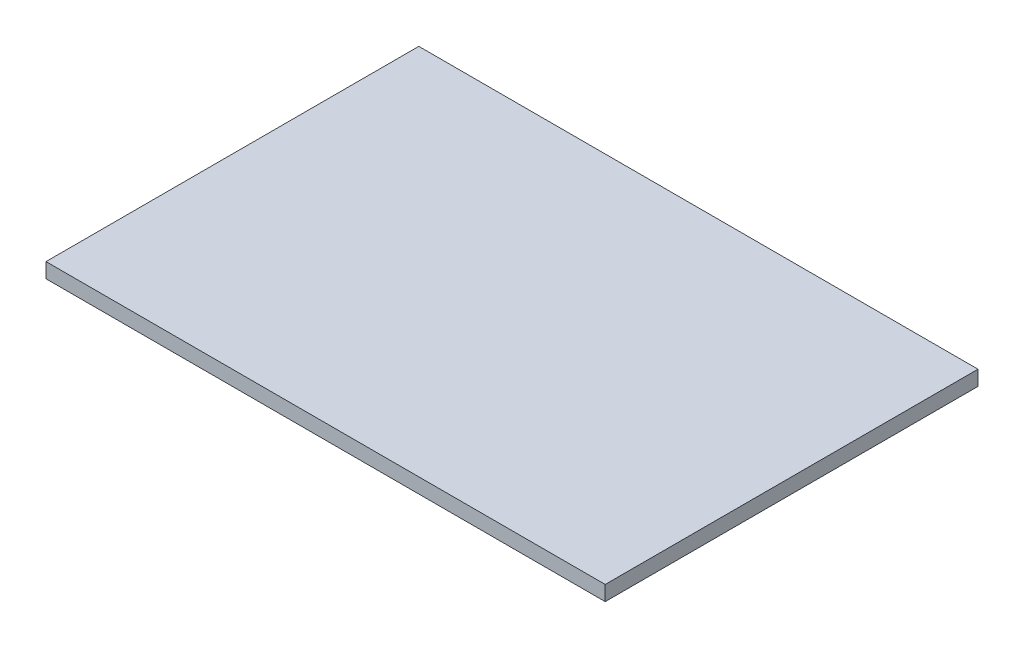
SolidWorks part; units mm, degrees
ref_plane "Face" through (0, 0, 0) normal (0, 0, 1) x (1, 0, 0)
ref_plane "Dessus" through (0, 0, 0) normal (0, 1, 0) x (1, 0, 0)
ref_plane "Droite" through (0, 0, 0) normal (1, 0, 0) x (0, 0, -1)
sketch "Esquisse1" plane through (0, 0, 0) normal (0, 1, 0) x (1, 0, 0)
  line L1 (0, 0) -> (600, 0)
  line L2 (0, 0) -> (0, 400)
  line L3 (0, 400) -> (600, 400)
  line L4 (600, 0) -> (600, 400)
  dimension "D1" = 400
  dimension "D2" = 600
extrude "Extrusion1" add sketch "Esquisse1" along normal blind 16
